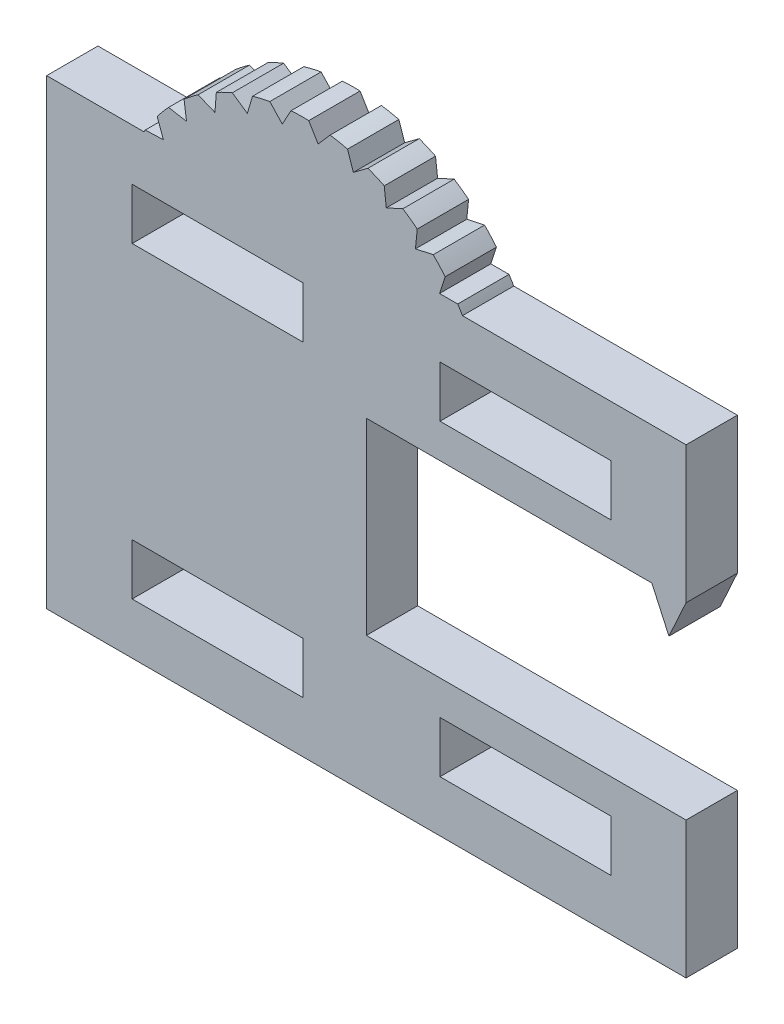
SolidWorks part; units mm, degrees
ref_plane "Plan de face" through (0, 0, 0) normal (0, 0, 1) x (1, 0, 0)
ref_plane "Plan de dessus" through (0, 0, 0) normal (0, 1, 0) x (1, 0, 0)
ref_plane "Plan de droite" through (0, 0, 0) normal (1, 0, 0) x (0, 0, -1)
sketch "Esquisse1" plane through (0, 0, 0) normal (0, 0, 1) x (1, 0, 0)
  line L0 (-8, 0) -> (-8, -6.4922) construction
  line L1 (-8, -6) -> (-45.3847, -6)
  line L2 (-8, -6) -> (-8, 21)
  line L3 (-8, 21) -> (-45.3847, 21)
  line L4 (-45.3847, -6) -> (-45.3847, 21)
  line L5 (-11.6923, 2) -> (-41.6923, 2)
  line L6 (-11.6923, 2) -> (-11.6923, 13)
  line L7 (-11.6923, 13) -> (-41.6923, 13)
  line L8 (-41.6923, 2) -> (-41.6923, 13)
  line L9 (0, -6) -> (-45.3847, -6) construction
  line L10 (-12.3847, -3) -> (-12.3847, 0) construction
  line L11 (-12.3847, -3) -> (-22.3847, -3) construction
  line L12 (-12.3847, 0) -> (-22.3847, 0) construction
  line L13 (-22.3847, -3) -> (-22.3847, 0) construction
  line L14 (-12.3847, -3) -> (-12.3847, 0)
  line L15 (-12.3847, -3) -> (-22.3847, -3)
  line L16 (-12.3847, 0) -> (-22.3847, 0)
  line L17 (-22.3847, -3) -> (-22.3847, 0)
  line L18 (-30.3847, -3) -> (-30.3847, 0) construction
  line L19 (-30.3847, 0) -> (-40.3847, 0) construction
  line L20 (-30.3847, -3) -> (-40.3847, -3) construction
  line L21 (-40.3847, -3) -> (-40.3847, 0) construction
  line L22 (-30.3847, -3) -> (-30.3847, 0)
  line L23 (-30.3847, 0) -> (-40.3847, 0)
  line L24 (-30.3847, -3) -> (-40.3847, -3)
  line L25 (-40.3847, -3) -> (-40.3847, 0)
  line L26 (-12.3847, 18) -> (-12.3847, 15) construction
  line L27 (-22.3847, 15) -> (-12.3847, 15) construction
  line L28 (-22.3847, 18) -> (-12.3847, 18) construction
  line L29 (-22.3847, 18) -> (-22.3847, 15) construction
  line L30 (-12.3847, 18) -> (-12.3847, 15)
  line L31 (-22.3847, 15) -> (-12.3847, 15)
  line L32 (-22.3847, 18) -> (-12.3847, 18)
  line L33 (-22.3847, 18) -> (-22.3847, 15)
  line L34 (-40.3847, 15) -> (-30.3847, 15) construction
  line L35 (-30.3847, 18) -> (-30.3847, 15) construction
  line L36 (-40.3847, 18) -> (-30.3847, 18) construction
  line L37 (-40.3847, 18) -> (-40.3847, 15) construction
  line L38 (-40.3847, 15) -> (-30.3847, 15)
  line L39 (-30.3847, 18) -> (-30.3847, 15)
  line L40 (-40.3847, 18) -> (-30.3847, 18)
  line L41 (-40.3847, 18) -> (-40.3847, 15)
  line L42 (-26.6923, 21) -> (-26.6923, -6) construction
  line L43 (-45.3847, 7.5) -> (-8, 7.5) construction
  dimension "D1" = 30
  dimension "D2" = 11
extrude "Boss.-Extru.1" add sketch "Esquisse1" along normal blind 3
sketch "Esquisse2" plane through (0, 0, 3) normal (0, 0, 1) x (1, 0, 0)
  line L0 (-11.6923, 13) -> (-41.6923, 13) construction
  line L1 (-41.6923, 2) -> (-26.6923, 2)
  line L2 (-41.6923, 2) -> (-41.6923, 13)
  line L3 (-41.6923, 13) -> (-26.6923, 13)
  line L4 (-26.6923, 2) -> (-26.6923, 13)
extrude "Boss.-Extru.2" add sketch "Esquisse2" against normal blind 3
sketch "Esquisse3" plane through (0, 0, 3) normal (0, 0, 1) x (1, 0, 0)
  line L0 (-8, -6) -> (-8, 21) construction
  line L1 (-11.6923, 13) -> (-8, 13)
  line L2 (-11.6923, 13) -> (-11.6923, 2)
  line L3 (-11.6923, 2) -> (-8, 2)
  line L4 (-8, 13) -> (-8, 2)
extrude "Enlèv. mat.-Extru.1" cut sketch "Esquisse3" against normal blind 3
sketch "Esquisse4" plane through (0, 0, 3) normal (0, 0, 1) x (1, 0, 0)
  line L0 (-9, 10.8091) -> (-9, 14.5827) construction
  line L2 (-8, 13) -> (-8, 21) construction
  line L3 (-8, 13) -> (-9, 10.8091)
  line L4 (-9, 10.8091) -> (-10, 13)
  line L5 (-8, 13) -> (-26.6923, 13) construction
  line L6 (-10, 13) -> (-8, 13)
  dimension "D1" = 1
extrude "Boss.-Extru.3" add sketch "Esquisse4" against normal blind 3
sketch "Esquisse5" plane through (0, 0, 3) normal (0, 0, 1) x (1, 0, 0)
  line L21 (-27.4523, 25.0665) -> (-27.7937, 26.0742)
  line L22 (-26.5988, 25.7019) -> (-27.4523, 25.0665)
  line L23 (-25.5267, 24.2324) -> (-25.647, 25.2896)
  line L24 (-24.5581, 24.6727) -> (-25.5267, 24.2324)
  line L25 (-23.8214, 23.0096) -> (-23.7152, 24.0683)
  line L26 (-22.7815, 23.2348) -> (-23.8214, 23.0096)
  line L27 (-22.4136, 21.4535) -> (-22.0856, 22.4657)
  line L28 (-21.3496, 21.4535) -> (-22.4136, 21.4535)
  line L29 (-39.6951, 21) -> (-21.0742, 21)
  line L30 (-38.5578, 21.1648) -> (-39.6212, 21.1268)
  line L31 (-38.9217, 22.1647) -> (-38.5578, 21.1648)
  line L32 (-37.2065, 22.7703) -> (-38.2538, 22.9582)
  line L33 (-37.3505, 23.8245) -> (-37.2065, 22.7703)
  line L34 (-35.546, 24.0533) -> (-36.5298, 24.4587)
  line L35 (-35.4635, 25.1141) -> (-35.546, 24.0533)
  line L36 (-33.6515, 24.9557) -> (-34.5271, 25.5601)
  line L37 (-33.3463, 25.975) -> (-33.6515, 24.9557)
  line L38 (-31.6089, 25.4365) -> (-32.3367, 26.2126)
  line L39 (-31.0948, 26.3681) -> (-31.6089, 25.4365)
  line L40 (-29.5108, 25.474) -> (-30.0578, 26.3866)
  line L41 (-28.8112, 26.2757) -> (-29.5108, 25.474)
  line L42 (-27.4523, 25.0665) -> (-27.7937, 26.0742)
  line L43 (-26.5988, 25.7019) -> (-27.4523, 25.0665)
  line L44 (-25.5267, 24.2324) -> (-25.647, 25.2896)
  line L45 (-24.5581, 24.6727) -> (-25.5267, 24.2324)
  line L46 (-23.8214, 23.0096) -> (-23.7152, 24.0683)
  line L47 (-22.7815, 23.2348) -> (-23.8214, 23.0096)
  line L48 (-22.4136, 21.4535) -> (-22.0856, 22.4657)
  line L49 (-21.3496, 21.4535) -> (-22.4136, 21.4535)
  line L50 (-39.6951, 21) -> (-21.0742, 21)
  line L51 (-38.5578, 21.1648) -> (-39.6212, 21.1268)
  line L52 (-38.9217, 22.1647) -> (-38.5578, 21.1648)
  line L53 (-37.2065, 22.7703) -> (-38.2538, 22.9582)
  line L54 (-37.3505, 23.8245) -> (-37.2065, 22.7703)
  line L55 (-35.546, 24.0533) -> (-36.5298, 24.4587)
  line L56 (-35.4635, 25.1141) -> (-35.546, 24.0533)
  line L57 (-33.6515, 24.9557) -> (-34.5271, 25.5601)
  line L58 (-33.3463, 25.975) -> (-33.6515, 24.9557)
  line L59 (-31.6089, 25.4365) -> (-32.3367, 26.2126)
  line L60 (-31.0948, 26.3681) -> (-31.6089, 25.4365)
  line L61 (-29.5108, 25.474) -> (-30.0578, 26.3866)
  line L62 (-28.8112, 26.2757) -> (-29.5108, 25.474)
  arc A11 (-25.647, 25.2896) -> (-26.5988, 25.7019) centre (-30.3847, 15.657) ccw
  arc A12 (-23.7152, 24.0683) -> (-24.5581, 24.6727) centre (-30.3847, 15.657) ccw
  arc A13 (-22.0856, 22.4657) -> (-22.7815, 23.2348) centre (-30.3847, 15.657) ccw
  arc A14 (-21.0742, 21) -> (-21.3496, 21.4535) centre (-30.3847, 15.657) ccw
  arc A15 (-39.6212, 21.1268) -> (-39.6951, 21) centre (-30.3847, 15.657) ccw
  arc A16 (-38.2538, 22.9582) -> (-38.9217, 22.1647) centre (-30.3847, 15.657) ccw
  arc A17 (-36.5298, 24.4587) -> (-37.3505, 23.8245) centre (-30.3847, 15.657) ccw
  arc A18 (-34.5271, 25.5601) -> (-35.4635, 25.1141) centre (-30.3847, 15.657) ccw
  arc A19 (-32.3367, 26.2126) -> (-33.3463, 25.975) centre (-30.3847, 15.657) ccw
  arc A20 (-30.0578, 26.3866) -> (-31.0948, 26.3681) centre (-30.3847, 15.657) ccw
  arc A21 (-27.7937, 26.0742) -> (-28.8112, 26.2757) centre (-30.3847, 15.657) ccw
  arc A22 (-25.647, 25.2896) -> (-26.5988, 25.7019) centre (-30.3847, 15.657) ccw
  arc A23 (-23.7152, 24.0683) -> (-24.5581, 24.6727) centre (-30.3847, 15.657) ccw
  arc A24 (-22.0856, 22.4657) -> (-22.7815, 23.2348) centre (-30.3847, 15.657) ccw
  arc A25 (-21.0742, 21) -> (-21.3496, 21.4535) centre (-30.3847, 15.657) ccw
  arc A26 (-39.6212, 21.1268) -> (-39.6951, 21) centre (-30.3847, 15.657) ccw
  arc A27 (-38.2538, 22.9582) -> (-38.9217, 22.1647) centre (-30.3847, 15.657) ccw
  arc A28 (-36.5298, 24.4587) -> (-37.3505, 23.8245) centre (-30.3847, 15.657) ccw
  arc A29 (-34.5271, 25.5601) -> (-35.4635, 25.1141) centre (-30.3847, 15.657) ccw
  arc A30 (-32.3367, 26.2126) -> (-33.3463, 25.975) centre (-30.3847, 15.657) ccw
  arc A31 (-30.0578, 26.3866) -> (-31.0948, 26.3681) centre (-30.3847, 15.657) ccw
  arc A32 (-27.7937, 26.0742) -> (-28.8112, 26.2757) centre (-30.3847, 15.657) ccw
  dimension "D1" = 0
extrude "Boss.-Extru.4" add sketch "Esquisse5" against normal blind 3
